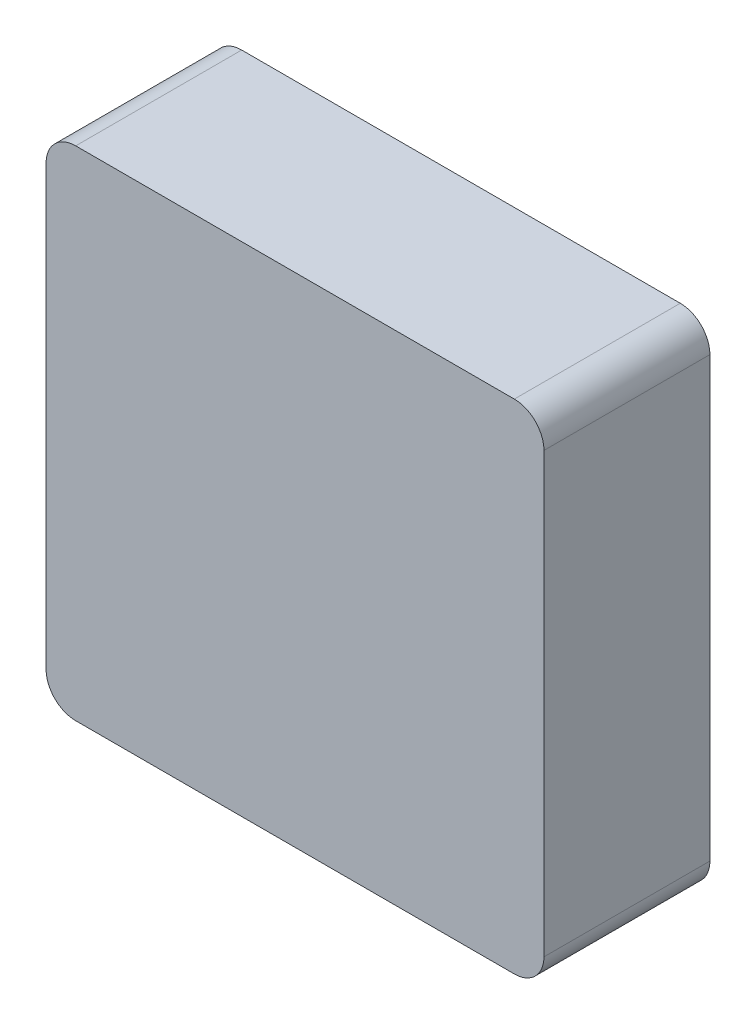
SolidWorks part; units mm, degrees
ref_plane "Front Plane" through (0, 0, 0) normal (1, 0, 0) x (0, 1, 0)
ref_plane "Top Plane" through (0, 0, 0) normal (0, 0, 1) x (0, 1, 0)
ref_plane "Right Plane" through (0, 0, 0) normal (0, 1, 0) x (-1, 0, 0)
sketch "Sketch1" plane through (0, 0, 0) normal (0, 0, 1) x (0, 1, 0)
  line L1 (-37, -42) -> (37, -42)
  line L2 (-42, -37) -> (-42, 37)
  line L3 (-37, 42) -> (37, 42)
  line L4 (42, -37) -> (42, 37)
  line L5 (-42, -42) -> (42, 42) construction
  line L6 (-42, 42) -> (42, -42) construction
  arc A0 (37, 42) -> (42, 37) centre (37, 37) cw
  arc A1 (42, -37) -> (37, -42) centre (37, -37) cw
  arc A2 (-37, -42) -> (-42, -37) centre (-37, -37) cw
  arc A3 (-42, 37) -> (-37, 42) centre (-37, 37) cw
  point P0 (0, 0)
  dimension "D3" = 5
  dimension "D1" = 84
  dimension "D2" = 84
extrude "Boss-Extrude1" add sketch "Sketch1" along normal blind 28
